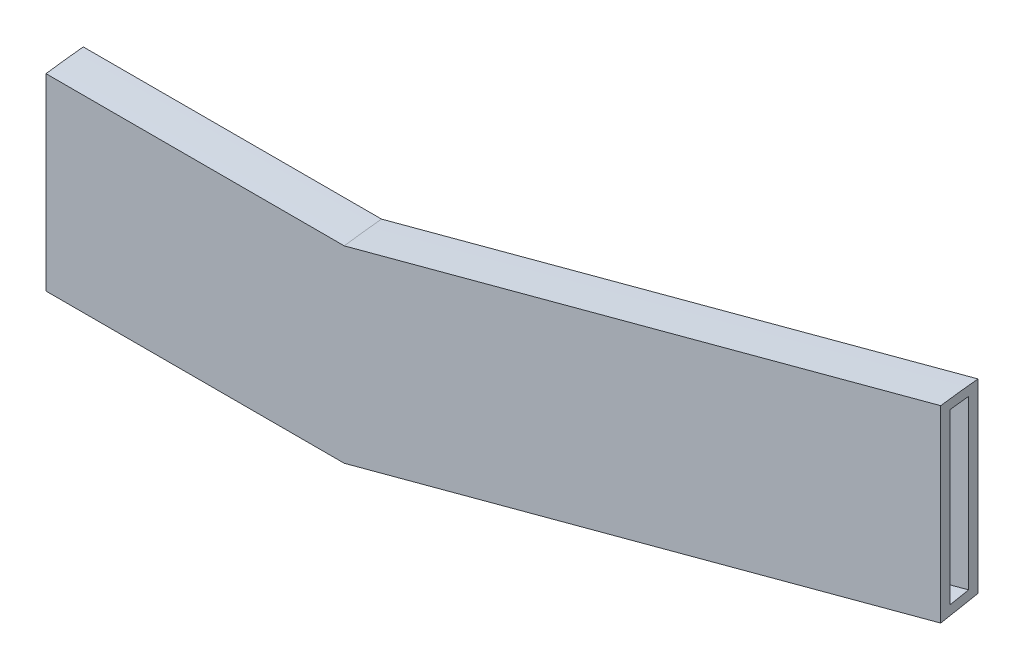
SolidWorks part; units mm, degrees
ref_plane "Front Plane" through (0, 0, 0) normal (0, 0, 1) x (1, 0, 0)
ref_plane "Top Plane" through (0, 0, 0) normal (0, 1, 0) x (1, 0, 0)
ref_plane "Right Plane" through (0, 0, 0) normal (1, 0, 0) x (0, 0, -1)
curve "Curve1"
sketch "Sketch1" plane through (0, 0, 0) normal (1, 0, 0) x (0, 0, -1)
  line L0 (32.5438, 18.2236) -> (32.5438, 2.1862)
  line L1 (0, 0) -> (0, 95.7684) construction
  line L4 (35.7188, 18.6104) -> (35.7187, 2.7868)
  line L5 (33.3375, 17.5323) -> (33.3375, 3.1448)
  line L6 (34.925, 17.7278) -> (34.925, 3.445)
  spline S0 degree 1 poles (34.925, 17.7278) (33.3375, 17.5323) knots 0 0 1 1 construction
  spline S1 degree 1 poles (33.3375, 3.1448) (34.925, 3.445) knots 0 0 1 1 construction
  spline S2 degree 3 poles (34.925, 17.7278) (34.3952, 17.6683) (33.8659, 17.6031) (33.3375, 17.5323) knots 0.373628 0.373628 0.373628 0.373628 0.378966 0.378966 0.378966 0.378966
  spline S3 degree 3 poles (33.3375, 3.1448) (33.8666, 3.2451) (34.3958, 3.3452) (34.925, 3.445) knots 0.626492 0.626492 0.626492 0.626492 0.631768 0.631768 0.631768 0.631768
  spline S4 degree 3 poles (32.5438, 2.1862) (33.6019, 2.3872) (34.6602, 2.5877) (35.7187, 2.7868) knots 0.623361 0.623361 0.623361 0.623361 0.633917 0.633917 0.633917 0.633917
  spline S5 degree 3 poles (35.7188, 18.6104) (34.6579, 18.504) (33.5991, 18.3748) (32.5438, 18.2236) knots 0.370698 0.370698 0.370698 0.370698 0.381261 0.381261 0.381261 0.381261
  dimension "D1" = 0.7937
extrude "Boss-Extrude1" add sketch "Sketch1" along normal blind 25.4
ref_plane "Plane1" through (76.2, 0, 0) normal (1, 0, 0) x (0, 0, -1)
sketch "Sketch4" plane through (0, 0, -32.5438) normal (0, 0, 1) x (1, 0, 0)
  line L0 (25.4, 2.1862) -> (76.2, 15.798)
  line L1 (76.2, -1.7462) -> (76.2, 1.7462) construction
  line L2 (25.4, 2.1862) -> (76.2, 2.1862) construction
  dimension "D1" = 15
sketch "Sketch7" plane through (25.4, 0, 0) normal (1, 0, 0) x (0, 0, -1)
  line L2 (33.3375, 17.5323) -> (33.3375, 3.1448)
  line L3 (34.925, 3.445) -> (34.925, 17.7278)
  line L4 (33.3375, 17.5323) -> (33.3375, 3.1448)
  line L5 (34.925, 3.445) -> (34.925, 17.7278)
  line L6 (32.5438, 18.2236) -> (32.5438, 2.1862)
  line L7 (35.7187, 2.7868) -> (35.7188, 18.6104)
  line L8 (32.5438, 18.2236) -> (32.5438, 2.1862)
  line L9 (35.7187, 2.7868) -> (35.7188, 18.6104)
  arc A2 (34.925, 3.445) -> (33.3375, 3.1448) centre (358.2969, -1710.7805) ccw
  arc A3 (34.925, 17.7278) -> (33.3375, 17.5323) centre (43.2849, -56.7055) ccw
  arc A4 (34.925, 3.445) -> (33.3375, 3.1448) centre (358.2969, -1710.7805) ccw
  arc A5 (34.925, 17.7278) -> (33.3375, 17.5323) centre (43.2849, -56.7055) ccw
  spline S2 degree 3 poles (-1007.3628, 2788.1322) (396.9964, -2913.3467) (-337.2167, 2917.6668) (1068.4864, -2787.387) knots -1.058146 -1.058146 -1.058146 -1.058146 2.288332 2.288332 2.288332 2.288332 only from (32.5438, 2.1862) to (35.7187, 2.7868)
  spline S3 degree 3 poles (-1668.5071, -2414.7589) (2558.4252, 2152.2862) (-2924.5658, -1636.6903) (2862.6229, 967.3231) knots -0.872323 -0.872323 -0.872323 -0.872323 1.778057 1.778057 1.778057 1.778057 only from (35.7188, 18.6104) to (32.5438, 18.2236)
  spline S4 degree 3 poles (32.5438, 2.1862) (33.6019, 2.3872) (34.6602, 2.5877) (35.7187, 2.7868) knots 0.623361 0.623361 0.623361 0.623361 0.633917 0.633917 0.633917 0.633917
  spline S5 degree 3 poles (35.7188, 18.6104) (34.6579, 18.504) (33.5991, 18.3748) (32.5438, 18.2236) knots 0.370698 0.370698 0.370698 0.370698 0.381261 0.381261 0.381261 0.381261
  dimension "D1" = 0
  dimension "D2" = 0
sweep "Sweep1" add profiles "Sketch7" path "Sketch4"
